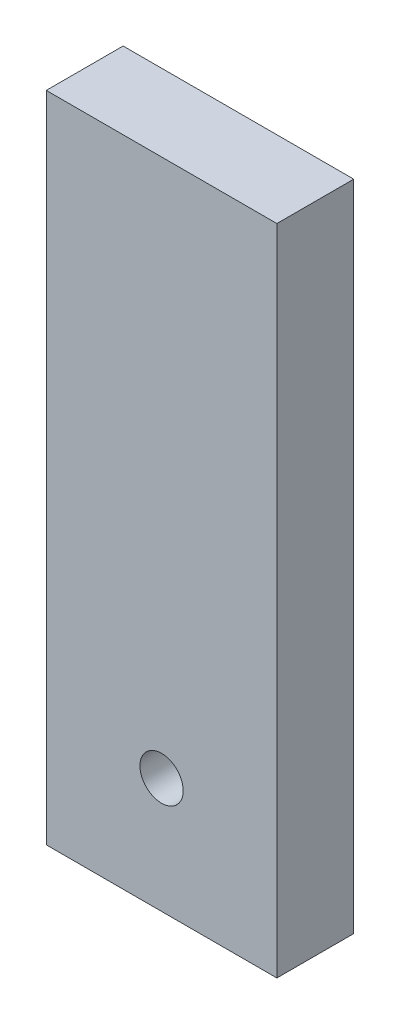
SolidWorks part; units mm, degrees
ref_plane "Front Plane" through (0, 0, 0) normal (0, 0, 1) x (1, 0, 0)
ref_plane "Top Plane" through (0, 0, 0) normal (0, 1, 0) x (1, 0, 0)
ref_plane "Right Plane" through (0, 0, 0) normal (1, 0, 0) x (0, 0, -1)
sketch "Sketch1" plane through (0, 0, 0) normal (0, 1, 0) x (1, 0, 0)
  line L1 (-61.0027, 25.7146) -> (91.3973, 25.7146)
  line L2 (-61.0027, 25.7146) -> (-61.0027, -25.0854)
  line L3 (-61.0027, -25.0854) -> (91.3973, -25.0854)
  line L4 (91.3973, 25.7146) -> (91.3973, -25.0854)
  dimension "D1" = 152.4
  dimension "D2" = 50.8
extrude "Boss-Extrude1" add sketch "Sketch1" along normal blind 431.8
hole_wizard "3/4 (0.75) Diameter Slot1" positions "Sketch3" profile "Sketch2" size "3/4" standard "ANSI Inch"
sketch "Sketch3" plane through (0, 0, 25.0854) normal (0, 0, 1) x (1, 0, 0)
  line L1 (-61.0027, 431.8) -> (-61.0027, 0) construction
  line L3 (-61.0027, 0) -> (91.3973, 0) construction
  point P7 (15.1973, 76.2)
  dimension "D1" = 76.2
  dimension "D4" = 76.2
sketch "Sketch2" plane through (15.1973, 76.2, 25.0854) normal (1, 0, 0) x (0, -1, 0)
  line L0 (0, 0) -> (0, 50.8)
  line L1 (0, 50.8) -> (14.2875, 50.8)
  line L2 (14.2875, 50.8) -> (14.2875, 0)
  line L5 (14.2875, 0) -> (0, 0)
  line L11 (0, -6.35) -> (0, 107.95) construction
  dimension "Thru Hole Dia." = 28.575
  dimension "Thru Hole Depth" = 50.8
hole_wizard "CSK for #8 Flat Head Machine Screw (100)1" positions "Sketch5" profile "Sketch4" countersink size "#8" standard "ANSI Inch"
sketch "Sketch5" plane through (0, 0, -25.7146) normal (0, 0, -1) x (-1, 0, 0)
  line L0 (48.3027, 431.8) -> (48.3027, 0) construction
  line L1 (48.3027, 215.9) -> (-91.3973, 215.9) construction
  line L2 (-91.3973, 431.8) -> (-91.3973, 0) construction
  point P0 (-72.3473, 241.3)
  point P2 (-72.3473, 196.85)
  dimension "D1" = 19.05
  dimension "D2" = 19.05
  dimension "D3" = 19.05
  dimension "D4" = 25.4
sketch "Sketch4" plane through (72.3473, 241.3, -25.7146) normal (1, 0, 0) x (0, 1, 0)
  line L0 (0, 0) -> (0, 50.8)
  line L1 (0, 50.8) -> (2.2479, 50.8)
  line L2 (2.2479, 50.8) -> (2.2479, 1.6518)
  line L3 (2.2479, 1.6518) -> (4.2164, 0)
  line L5 (4.2164, 0) -> (0, 0)
  line L6 (-2.2479, 1.6518) -> (-4.2164, 0) construction
  line L11 (0, -6.35) -> (0, 107.95) construction
  dimension "Thru Hole Dia." = 4.4958
  dimension "Thru Hole Depth" = 50.8
  dimension "Near C'Sink Dia." = 8.4328
  dimension "Near C'Sink Angle" = 100
hole_wizard "CSK for #8 Flat Head Machine Screw (100)2" positions "Sketch7" profile "Sketch6" countersink size "#8" standard "ANSI Inch"
sketch "Sketch7" plane through (0, 0, 25.0854) normal (0, 0, 1) x (1, 0, 0)
  line L0 (91.3973, 431.8) -> (91.3973, 0) construction
  line L1 (91.3973, 215.9) -> (-61.0027, 215.9) construction
  line L2 (-61.0027, 431.8) -> (-61.0027, 0) construction
  point P0 (72.3473, 241.3)
  point P2 (72.3473, 196.85)
  dimension "D1" = 19.05
  dimension "D2" = 19.05
  dimension "D3" = 25.4
  dimension "D4" = 19.05
sketch "Sketch6" plane through (72.3473, 241.3, 25.0854) normal (1, 0, 0) x (0, -1, 0)
  line L0 (0, 0) -> (0, 50.8)
  line L1 (0, 50.8) -> (2.2479, 50.8)
  line L2 (2.2479, 50.8) -> (2.2479, 1.6518)
  line L3 (2.2479, 1.6518) -> (4.2164, 0)
  line L5 (4.2164, 0) -> (0, 0)
  line L6 (-2.2479, 1.6518) -> (-4.2164, 0) construction
  line L11 (0, -6.35) -> (0, 107.95) construction
  dimension "Thru Hole Dia." = 4.4958
  dimension "Thru Hole Depth" = 50.8
  dimension "Near C'Sink Dia." = 8.4328
  dimension "Near C'Sink Angle" = 100
